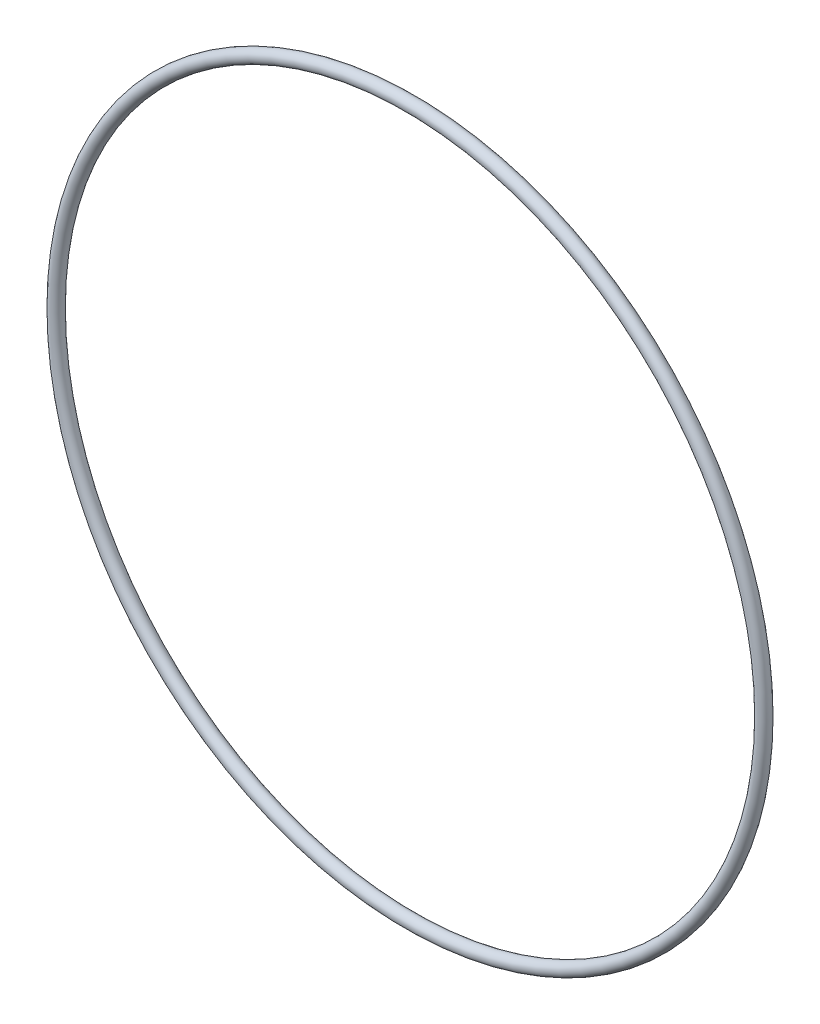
SolidWorks part; units mm, degrees
ref_plane "Plan de face" through (0, 0, 0) normal (0, 0, 1) x (1, 0, 0)
ref_plane "Plan de dessus" through (0, 0, 0) normal (0, 1, 0) x (1, 0, 0)
ref_plane "Plan de droite" through (0, 0, 0) normal (1, 0, 0) x (0, 0, -1)
sketch "Esquisse1" plane through (0, 0, 0) normal (0, 0, 1) x (1, 0, 0)
  circle A0 centre (0, 0) radius 326
  dimension "D1" = 652
sketch "Esquisse2" plane through (0, 0, 0) normal (0, 1, 0) x (1, 0, 0)
  line L0 (-326, 0) -> (326, 0) construction
  circle A0 centre (-326, 0) radius 6
  dimension "D1" = 12
sweep "Balayage1" add profiles "Esquisse2" path "Esquisse1"
